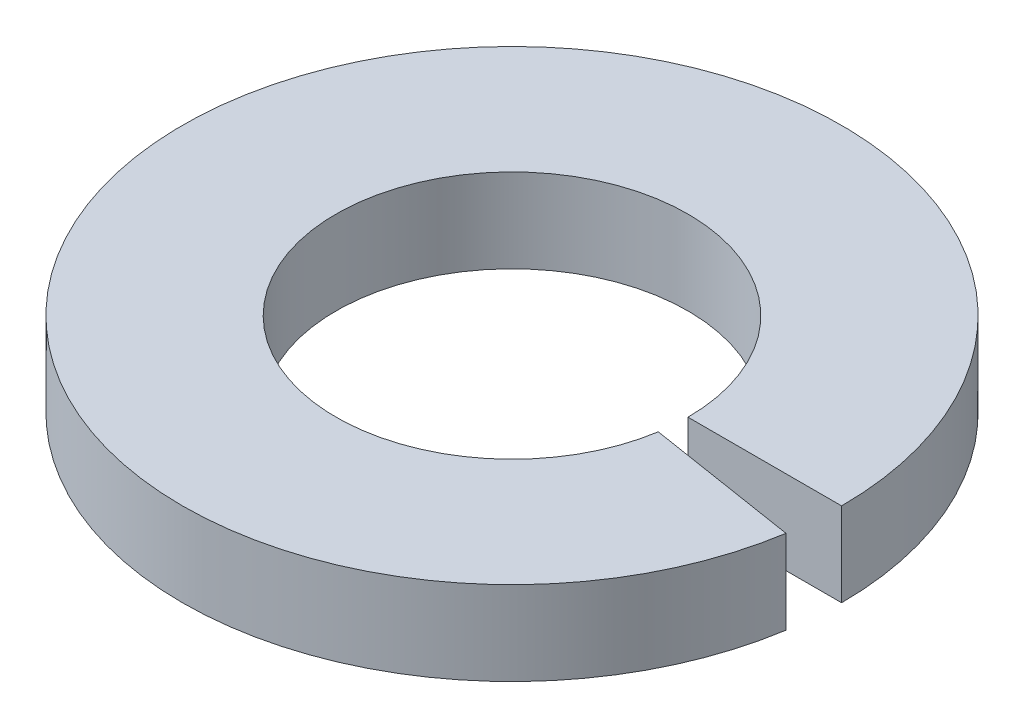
SolidWorks part; units mm, degrees
ref_plane "Front" through (0, 0, 0) normal (0, 0, 1) x (1, 0, 0)
ref_plane "Top" through (0, 0, 0) normal (0, 1, 0) x (1, 0, 0)
ref_plane "Right" through (0, 0, 0) normal (1, 0, 0) x (0, 0, -1)
sketch "Sketch1" plane through (0, 0, 0) normal (0, 0, 1) x (1, 0, 0)
  line L0 (0, -78.74) -> (0, 80.3148) construction
  line L1 (3.302, 0) -> (3.302, 1.5748)
  line L2 (3.302, 1.5748) -> (6.1849, 1.5748)
  line L3 (6.1849, 1.5748) -> (6.1849, 0)
  line L4 (6.1849, 0) -> (3.302, 0)
revolve "Base-Revolve" add sketch "Sketch1" angle 351 about L0
